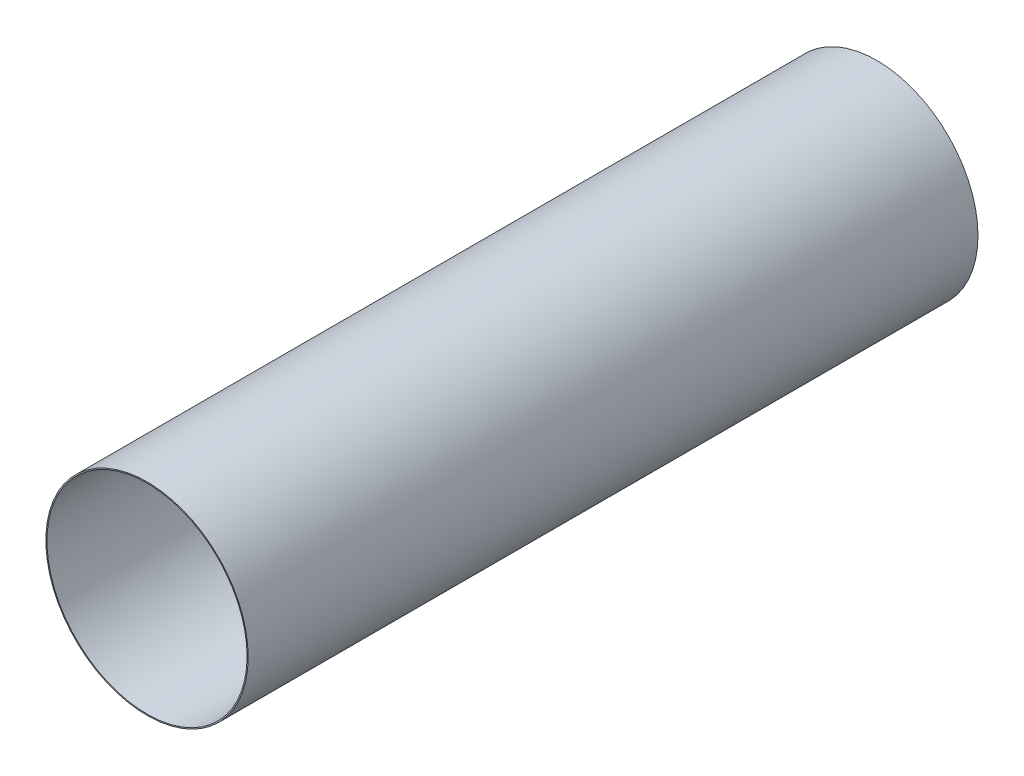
SolidWorks part; units mm, degrees
ref_plane "Plan de face" through (0, 0, 0) normal (0, 0, 1) x (1, 0, 0)
ref_plane "Plan de dessus" through (0, 0, 0) normal (0, 1, 0) x (1, 0, 0)
ref_plane "Plan de droite" through (0, 0, 0) normal (1, 0, 0) x (0, 0, -1)
sketch "Esquisse1" plane through (0, 0, 0) normal (0, 0, 1) x (1, 0, 0)
  circle A0 centre (0, 0) radius 457.5
  circle A1 centre (0, 0) radius 452.5
  dimension "D1" = 915
  dimension "D2" = 5
extrude "Boss.-Extru.1" add sketch "Esquisse1" along normal blind 3300
